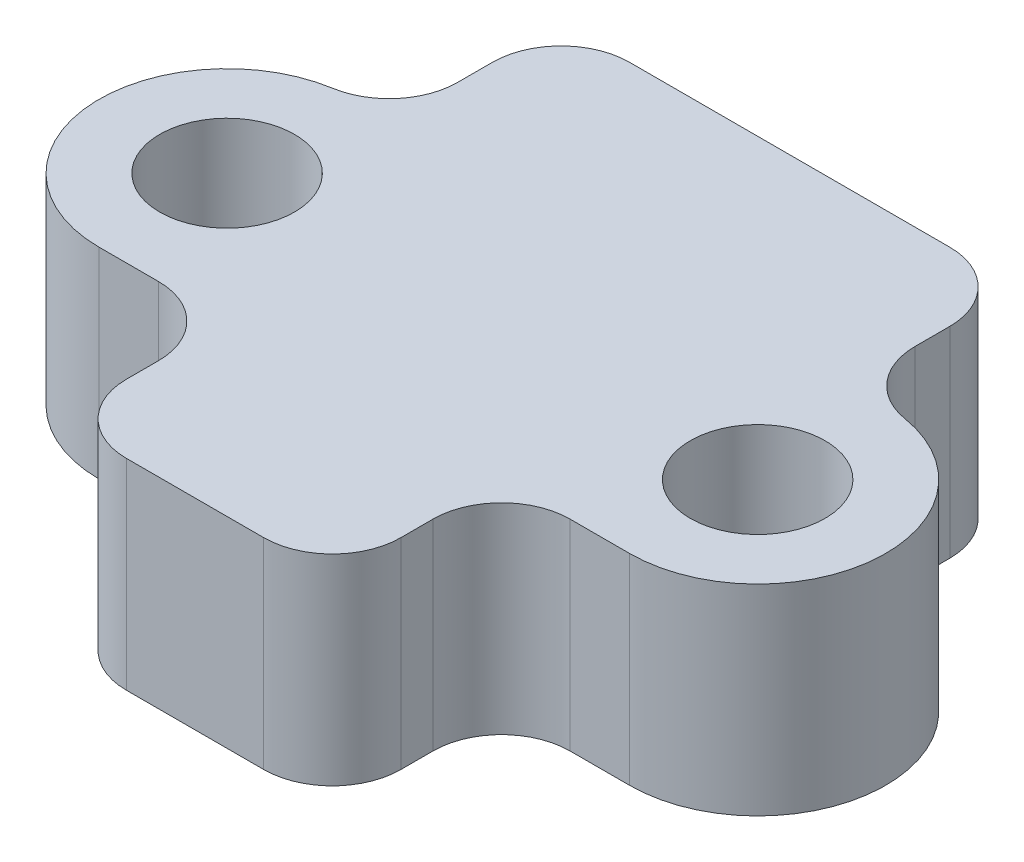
SolidWorks part; units mm, degrees
ref_plane "X_Y" through (0, 0, 0) normal (0, 0, 1) x (1, 0, 0)
ref_plane "Z_X" through (0, 0, 0) normal (0, 1, 0) x (1, 0, 0)
ref_plane "Y_Z" through (0, 0, 0) normal (1, 0, 0) x (0, 0, -1)
ref_plane "X_Y-_6021_master" through (0, 0, 0) normal (0, 0, 1) x (1, 0, 0)
ref_plane "Z_X_peltier-_6021_master" through (0, 0, 0) normal (0, 1, 0) x (1, 0, 0)
ref_plane "Y_Z-_6021_master" through (0, 0, 0) normal (1, 0, 0) x (0, 0, -1)
sketch "zx_sketch-_6021_master" plane through (0, 0, 0) normal (0, 1, 0) x (1, 0, 0)
  line L0 (0, 0) -> (0, 39833.2138) construction
  line L1 (-56.5, 24.66) -> (4, 24.66)
  line L2 (-56.5, 24.66) -> (-56.5, -27)
  line L3 (-56.5, -27) -> (56.5, -27)
  line L4 (56.5, 27) -> (56.5, -27)
  line L5 (0, 0) -> (39833.2138, 0) construction
  line L6 (4, 24.66) -> (4, 27)
  line L11 (4, 27) -> (56.5, 27)
  point P3 (0, -27)
  point P17 (-22.5, 15.66)
  point P18 (22.5, 15.66)
  point P19 (22.5, -15.66)
  point P20 (-22.5, -15.66)
  dimension "D1" = 113
  dimension "D2" = 24.66
  dimension "D3" = 45
  dimension "D4" = 31.32
  dimension "D5" = 27
  dimension "D6" = 2.34
  dimension "D7" = 4
  dimension "D8" = 27
sketch "xy_sketch-_6021_master" plane through (0, 0, 0) normal (0, 0, 1) x (1, 0, 0)
  line L0 (0, 0) -> (0, 5) construction
  line L1 (0, 5) -> (0, 7.3) construction
  dimension "D1" = 5
  dimension "D2" = 2.3
ref_plane "zx_lower_plate-_6021_master" through (0, 5, 0) normal (0, 1, 0) x (1, 0, 0)
ref_plane "zx_sensor-_6021_master" through (0, 7.3, 0) normal (0, 1, 0) x (1, 0, 0)
sketch "zx_sensor_sketch-_6021_master" plane through (0, 7.3, 0) normal (0, 1, 0) x (1, 0, 0)
  line L0 (-42.2, 3.16) -> (-28.2, 8.66) construction
  line L1 (-28.2, 8.66) -> (-14.2, 3.16) construction
  line L2 (-14.2, 3.16) -> (-0.2, 8.66) construction
  line L3 (-42.2, 4.96) -> (-42.2, -0.8) construction
  line L4 (-28.2, 10.46) -> (-28.2, 4.7) construction
  line L5 (-14.2, 4.96) -> (-14.2, -0.8) construction
  line L6 (-0.2, 10.46) -> (-0.2, 4.7) construction
  line L7 (-42.2, 3.16) -> (-42.2, -0.8) construction
  line L8 (-28.2, 8.66) -> (-28.2, 4.7) construction
  line L9 (-14.2, 3.16) -> (-14.2, -0.8) construction
  line L10 (-0.2, 8.66) -> (-0.2, 4.7) construction
  line L11 (-39.215, 3.16) -> (-45.185, 3.16) construction
  line L12 (-39.215, 7.475) -> (-39.215, -1.155) construction
  line L13 (-44.615, 3.16) -> (-39.785, 3.16) construction
  point P8 (-42.2, 2.08)
  point P16 (-42.2, 3.16)
  point P19 (-39.215, 3.16)
  point P22 (-42.2, 3.16)
  dimension "D3" = 14
  dimension "D4" = 1.08
  dimension "D6" = 5.76
  dimension "D7" = 5.97
  dimension "D9" = 8.63
  dimension "D10" = 4.83
  dimension "D11" = 5.5
sketch "zx_valve_sketch-_6021_master" plane through (0, 8.2, 0) normal (0, 1, 0) x (1, 0, 0)
  line L0 (44, -4.25) -> (34, -4.25) construction
  line L1 (34, -4.25) -> (24, -4.25) construction
  line L2 (24, -4.25) -> (14, -4.25) construction
  line L3 (44, -10.5) -> (44, -6.5) construction
  line L4 (44, -6.5) -> (44, -2.5) construction
  line L5 (34, -2.5) -> (34, -6.5) construction
  line L6 (34, -6.5) -> (34, -10.5) construction
  line L7 (24, -2.5) -> (24, -6.5) construction
  line L8 (24, -6.5) -> (24, -10.5) construction
  line L9 (14, -2.5) -> (14, -6.5) construction
  line L10 (14, -6.5) -> (14, -10.5) construction
  line L11 (44, 10.5) -> (44, -19) construction
  line L12 (34, 10.5) -> (34, -19) construction
  line L14 (24, -19) -> (24, 10.5) construction
  line L17 (14, 10.5) -> (14, -19) construction
  point P20 (44, -4.25)
  dimension "D1" = 10
  dimension "D4" = 8
  dimension "D5" = 2.25
  dimension "D6" = 29.5
sketch "zx_manifold_sketch-_6021_master" plane through (0, 5, 0) normal (0, 1, 0) x (1, 0, 0)
  line L0 (-34.0003, 7.58) -> (-22.3997, 7.58) construction
  line L4 (44, 19.5) -> (34, 19.5) construction
  line L5 (34, 19.5) -> (24, 19.5) construction
  line L6 (24, 19.5) -> (14, 19.5) construction
  line L7 (39, 10.5) -> (39, -7.6132)
  line L9 (-48.0003, 2.08) -> (-36.3997, 2.08) construction
  line L11 (-20.0003, 2.08) -> (-8.3997, 2.08) construction
  line L12 (-6.0003, 7.58) -> (5.6003, 7.58) construction
  line L13 (-48.9, -6.72) -> (-2.2958, -6.72)
  line L15 (14, -6.5) -> (24, -6.5)
  line L17 (-14.2, 4.96) -> (-9.7626, 10.5608)
  line L22 (34, -4.7265) -> (44, -4.7265) construction
  line L23 (44, -4.7265) -> (39, -7.6132) construction
  line L24 (-4.2467, 12.0482) -> (-0.2, 10.46)
  line L26 (44, 22) -> (14, 22)
  line L28 (-48.9, -14.72) -> (-30.3969, -14.72)
  line L30 (10.8896, -9.015) -> (7.7791, -11.53) construction
  line L31 (34, -14.5) -> (45, -14.5)
  line L32 (-22.5, -24) -> (44, -24)
  line L35 (-14.2, -0.8) -> (-18.2467, -2.3882)
  line L38 (-52.7667, 2.6469) -> (-51, 17.5)
  line L39 (-28.2, 4.7) -> (-23.7626, -0.9008)
  line L40 (14, 10.5) -> (22.5, 15.66) construction
  line L43 (49, -19) -> (49, -18.5)
  line L45 (-32.2467, 12.0482) -> (-28.2, 10.46)
  line L46 (-37.7626, 10.5608) -> (-42.2, 4.96)
  line L47 (-42.2, -0.8) -> (-46.2467, -2.3882)
  line L48 (-0.2, 4.7) -> (10.8896, -9.015)
  circle A0 centre (34, 19.5) radius 3.85 construction
  circle A1 centre (44, 19.5) radius 3.85 construction
  circle A2 centre (24, 19.5) radius 3.85 construction
  circle A3 centre (14, 19.5) radius 3.85 construction
  arc A4 (34, -10.5) -> (39, -7.6132) centre (34, -4.7265) ccw
  arc A6 (29, 10.5) -> (34, -2.5) centre (48.4, 10.5) ccw
  arc A7 (44, -10.5) -> (39, -7.6132) centre (44, -4.7265) cw
  arc A8 (44, -2.5) -> (49, 10.5) centre (29.6, 10.5) ccw
  arc A11 (45.3208, 21.6226) -> (44, 22) centre (44, 19.5) ccw
  arc A12 (44, -6.5) -> (51.5, 10.5) centre (28.4833, 10.5) ccw
  arc A13 (14, 22) -> (11.6636, 20.3896) centre (14, 19.5) ccw
  arc A15 (34, -14.5) -> (34, -6.5) centre (34, -10.5) cw
  arc A16 (-48.9, -6.72) -> (-48.9, -14.72) centre (-48.9, -10.72) ccw
  arc A17 (44, -24) -> (49, -19) centre (44, -19) ccw
  arc A18 (-22.5, -24) -> (-26.4485, -19.36) centre (-22.5, -20) cw
  arc A19 (-30.3969, -14.72) -> (-26.4485, -19.36) centre (-30.3969, -18.72) cw
  arc A20 (14, -10.5) -> (10.8896, -9.015) centre (14, -6.5) cw
  arc A21 (-4.2467, 12.0482) -> (-9.7626, 10.5608) centre (-6.0003, 7.58) ccw
  circle A22 centre (-51, 17.5) radius 3.85 construction
  arc A23 (-23.7626, -0.9008) -> (-18.2467, -2.3882) centre (-20.0003, 2.08) ccw
  arc A24 (-32.2467, 12.0482) -> (-37.7626, 10.5608) centre (-34.0003, 7.58) ccw
  arc A25 (-46.2467, -2.3882) -> (-52.7667, 2.6469) centre (-48.0003, 2.08) cw
  arc A26 (49, -18.5) -> (45, -14.5) centre (45, -18.5) ccw
  circle A27 centre (-51, 17.5) radius 5.5 construction
  arc A29 (14, 19.5) -> (19, 10.5) centre (8.4, 10.5) cw
  arc A30 (39, 10.5) -> (34, 19.5) centre (28.4, 10.5) ccw
  arc A31 (49, 10.5) -> (44, 19.5) centre (38.4, 10.5) ccw
  arc A32 (29, 10.5) -> (24, 19.5) centre (18.4, 10.5) ccw
  arc A33 (19, 10.5) -> (24, -2.5) centre (38.4, 10.5) ccw
  arc A35 (45.3208, 21.6226) -> (51.5, 10.5) centre (38.4, 10.5) cw
  arc A36 (14, -2.5) -> (11.6636, 20.3896) centre (35.6147, 11.2703) cw
  arc A37 (19.5172, -12.2931) -> (7.7791, -11.53) centre (14, -6.5) cw
  arc A38 (7.7791, -11.53) -> (-2.2958, -6.72) centre (-2.2958, -19.6763) ccw
  arc A39 (24, -10.5) -> (19.5172, -12.2931) centre (24, -17) ccw
  point P73 (0, 0)
  point P75 (0, 0)
  point P107 (0, 0)
  point P121 (-42.2, 2.08)
  dimension "D1" = 30
  dimension "D2" = 7.7
  dimension "D4" = 2.5
  dimension "D5" = 4
  dimension "D6" = 92.9
  dimension "D9" = 4
  dimension "D15" = 4
  dimension "D18" = 4.8
  dimension "D11" = 4
sketch "zx_screws_sketch-_6021_master" plane through (0, 5, 0) normal (0, 1, 0) x (1, 0, 0)
  line L4 (-34.0003, 7.58) -> (-22.3997, 7.58) construction
  line L5 (-20.0003, 2.08) -> (-8.3997, 2.08) construction
  line L6 (-6.0003, 7.58) -> (5.6003, 7.58) construction
  line L7 (-36.3997, 2.08) -> (-48.0003, 2.08) construction
  line L13 (56.5, 27) -> (56.5, -27) construction
  circle A0 centre (52.5, 23) radius 4 construction
  circle A3 centre (52.5, -23) radius 4 construction
  arc A7 (-52.7667, 2.6469) -> (-46.2467, -2.3882) centre (-48.0003, 2.08) ccw construction
  circle A8 centre (-52.5, -23) radius 4 construction
  point P0 (-0.2, -19)
  point P1 (52.5, -23)
  point P2 (52.5, 23)
  point P3 (6.6, 23)
  point P4 (-52.5, -23)
  point P5 (-42.2, 17.5)
ref_plane "zx_sensor_shelf-_6021_master" through (0, 9.691, 0) normal (0, 1, 0) x (1, 0, 0)
ref_plane "yz_sensor-_6021_master" through (-42.2, 0, 0) normal (1, 0, 0) x (0, 0, -1)
ref_plane "zx_valve-_6021_master" through (0, 8.2, 0) normal (0, 1, 0) x (1, 0, 0)
sketch "xz_cover-_6021_master" plane through (0, 0, 0) normal (0, 1, 0) x (1, 0, 0)
  line L1 (-63, -36.79) -> (63, -36.79)
  line L2 (-71.85, -27.94) -> (-71.85, 30.02)
  line L3 (-71.85, 30.02) -> (71.85, 30.02)
  line L4 (71.85, -27.94) -> (71.85, 30.02)
  line L5 (-71.85, -36.79) -> (71.85, 30.02) construction
  line L6 (-71.85, 30.02) -> (71.85, -36.79) construction
  line L7 (0, -1003.385) -> (0, 48996.615) construction
  arc A0 (71.85, -27.94) -> (63, -36.79) centre (63, -27.94) cw
  arc A1 (-63, -36.79) -> (-71.85, -27.94) centre (-63, -27.94) cw
  circle A2 centre (-64.495, 5.21) radius 3.6
  circle A3 centre (64.495, 5.21) radius 3.6
  point P0 (0, -3.385)
  dimension "D4" = 8.85
  dimension "D5" = 42
  dimension "D7" = 7.2
  dimension "D1" = 66.81
  dimension "D2" = 143.7
  dimension "D6" = 128.99
inserted part "_6021_master"
sketch "Sketch1" plane through (0, 9.691, 0) normal (0, 1, 0) x (1, 0, 0)
  line L0 (-39.2, -0.72) -> (-39.2, -4.42)
  line L4 (-42.2, -4.42) -> (-42.2, 8.58)
  line L5 (-42.2, 8.58) -> (-37.2, 8.58)
  line L6 (-37.2, 8.58) -> (-37.2, 4.88)
  line L8 (-36.3997, 4.88) -> (-37.2, 4.88)
  line L11 (-39.2, -0.72) -> (-36.3997, -0.72)
  line L12 (-39.2, -4.42) -> (-42.2, -4.42)
  arc A0 (-36.3997, 4.88) -> (-36.3997, -0.72) centre (-36.3997, 2.08) cw
  dimension "D7" = 5.6
  dimension "D1" = 13
  dimension "D2" = 3
  dimension "D4" = 5
extrude "Boss-Extrude1" add sketch "Sketch1" along normal blind 2 and the other way up to surface
hole_wizard "#4 Clearance Hole1" positions "Sketch2" profile "Sketch4" hole size "#4" standard "ANSI Inch"
sketch "Sketch2" plane through (0, 11.691, 0) normal (0, 1, 0) x (1, 0, 0)
  point P0 (-36.3997, 2.08)
sketch "Sketch4" plane through (-36.3997, 11.691, -2.08) normal (1, 0, 0) x (0, 0, 1)
  line L0 (0, 0) -> (0, 4.391)
  line L1 (0, 4.391) -> (1.4732, 4.391)
  line L2 (1.4732, 4.391) -> (1.4732, 0)
  line L5 (1.4732, 0) -> (0, 0)
  line L11 (0, -6.35) -> (0, 107.95) construction
  dimension "Thru Hole Dia." = 2.9464
  dimension "Thru Hole Depth" = 4.391
fillet "Fillet1" radius 1.5 4 edges at (-37.2, 9.4955, -4.88) (-39.2, 9.4955, 4.42) (-39.2, 9.4955, 0.72) (-37.2, 9.4955, -8.58)
mirror "Mirror1" about plane through (-42.2, 0, 0) normal (1, 0, 0)
